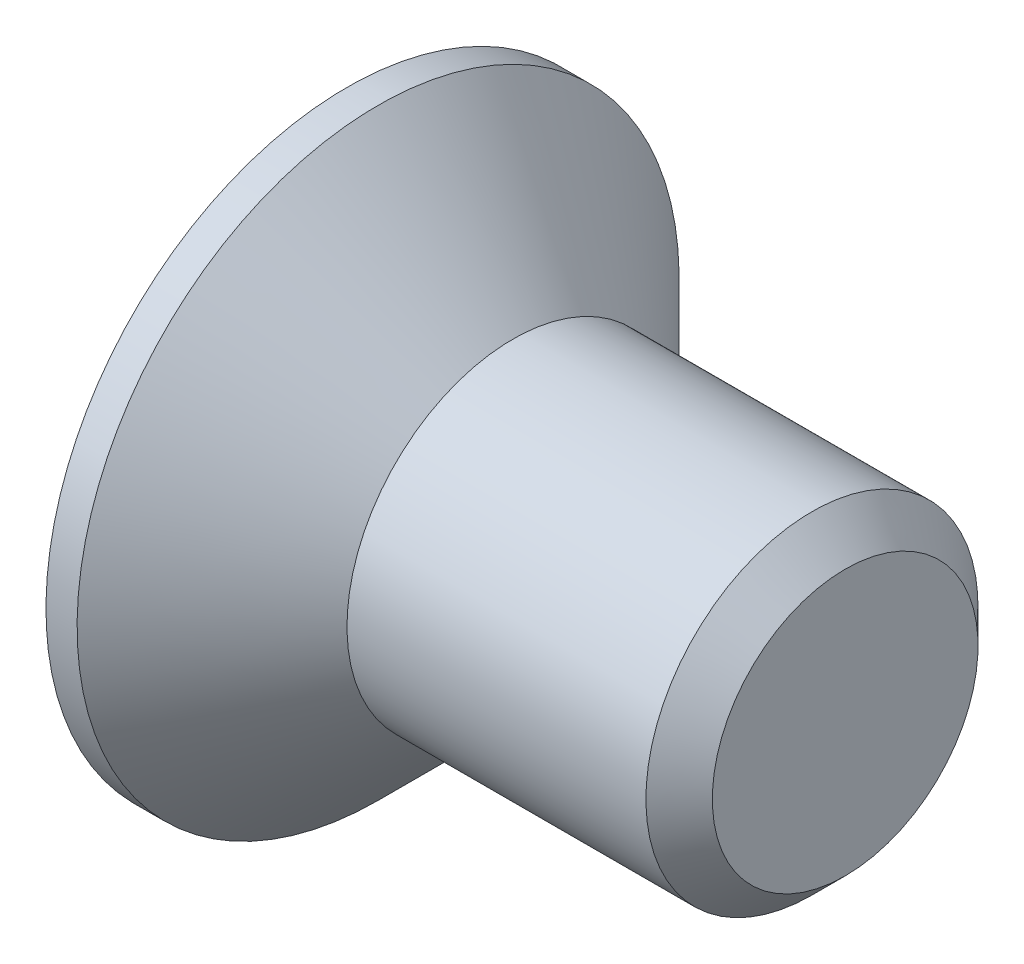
SolidWorks part; units mm, degrees
ref_plane "Front Plane" through (0, 0, 0) normal (0, 0, 1) x (1, 0, 0)
ref_plane "Top Plane" through (0, 0, 0) normal (0, 1, 0) x (1, 0, 0)
ref_plane "Right Plane" through (0, 0, 0) normal (1, 0, 0) x (0, 0, -1)
sketch "Sketch1" plane through (0, 0, 0) normal (0, 0, 1) x (1, 0, 0)
  line L1 (-4, 7.25) -> (-4, 0)
  line L2 (-4, 0) -> (8, 0)
  line L3 (8, 0) -> (8, 4)
  line L4 (8, 4) -> (0, 4)
  line L5 (-4, 7.25) -> (-3.25, 7.25)
  line L6 (-3.25, 7.25) -> (0, 4)
  dimension "D1" = 4
  dimension "D2" = 45
  dimension "D3" = 4
  dimension "D4" = 12
  dimension "D5" = 7.25
revolve "Revolve1" add sketch "Sketch1" angle 360 about L2
chamfer "Chamfer1" distance 0.8 angle 45 1 edges at (8, -4, 0)
sketch "Sketch2" plane through (-4, 0, 0) normal (-1, 0, 0) x (0, 0, 1)
  line L0 (-1.09, 4.35) -> (1.09, 4.35)
  line L1 (1.09, 4.35) -> (1.09, 1.09)
  line L2 (1.09, 1.09) -> (4.35, 1.09)
  line L3 (4.35, 1.09) -> (4.35, -1.09)
  line L4 (4.35, -1.09) -> (1.09, -1.09)
  line L5 (1.09, -1.09) -> (1.09, -4.35)
  line L6 (1.09, -4.35) -> (-1.09, -4.35)
  line L7 (-1.09, -4.35) -> (-1.09, -1.09)
  line L8 (-1.09, -1.09) -> (-4.35, -1.09)
  line L9 (-4.35, -1.09) -> (-4.35, 1.09)
  line L10 (-4.35, 1.09) -> (-1.09, 1.09)
  line L11 (-1.09, 1.09) -> (-1.09, 4.35)
  point P2 (0, 4.35)
  point P14 (0, -4.35)
  point P15 (4.35, 0)
  point P16 (-4.35, 0)
  point P17 (0.2443, 1.0495)
  point P18 (1.175, 0.2864)
  dimension "D1" = 8.7
  dimension "D2" = 2.18
extrude "Cut-Extrude1" cut sketch "Sketch2" against normal blind 3.45
